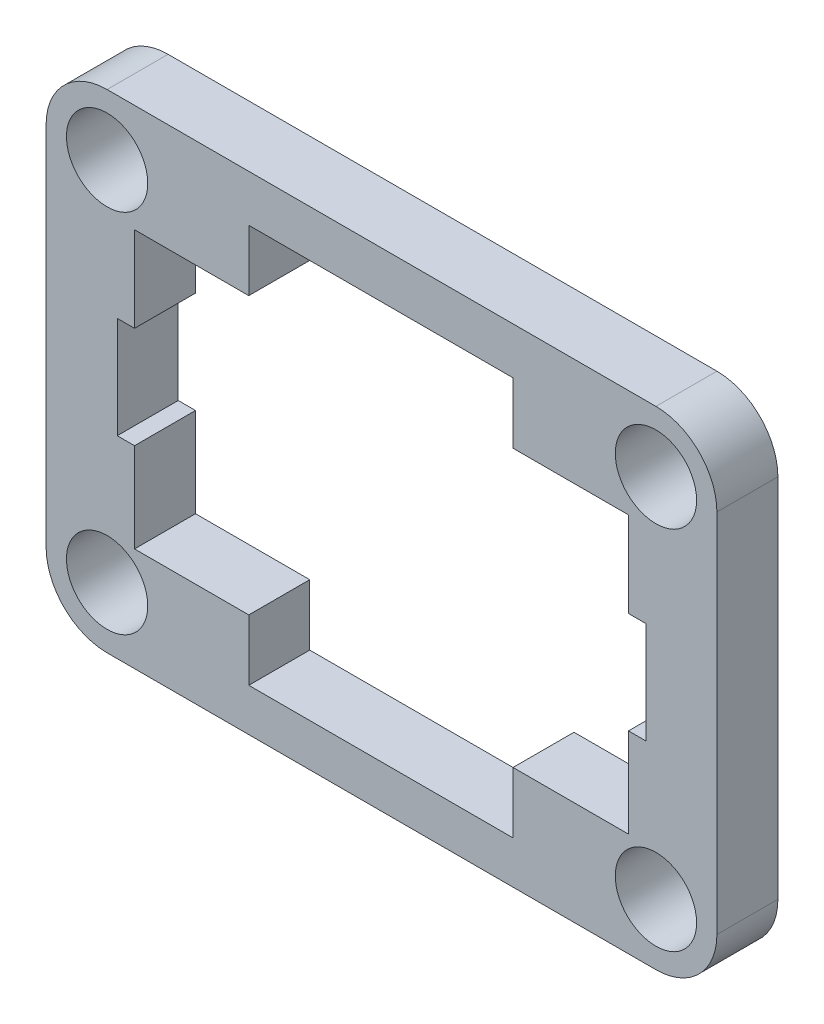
SolidWorks part; units mm, degrees
ref_plane "Front Plane" through (0, 0, 0) normal (0, 0, 1) x (1, 0, 0)
ref_plane "Top Plane" through (0, 0, 0) normal (0, 1, 0) x (1, 0, 0)
ref_plane "Right Plane" through (0, 0, 0) normal (1, 0, 0) x (0, 0, -1)
imported_body "Imported1"
sketch "Sketch1" plane through (0, 0, 0) normal (0, 0, 1) x (1, 0, 0)
  line L0 (28.38, -15.95) -> (34, -15.95)
  line L1 (47, -15.95) -> (52.68, -15.95)
  line L2 (28.38, -15.95) -> (28.38, -29.55)
  line L4 (52.68, -15.95) -> (52.68, -29.55)
  line L5 (52.68, -29.55) -> (47, -29.55)
  line L6 (34, -15.95) -> (34, -12.95)
  line L7 (34, -12.95) -> (47, -12.95)
  line L8 (47, -15.95) -> (47, -12.95)
  line L9 (34, -29.55) -> (28.38, -29.55)
  line L10 (47, -29.55) -> (47, -32.55)
  line L11 (47, -32.55) -> (34, -32.55)
  line L12 (34, -29.55) -> (34, -32.55)
extrude "Cut-Extrude1" cut sketch "Sketch1" along normal blind 3
sketch "Sketch2" plane through (0, 0, 3) normal (0, 0, 1) x (1, 0, 0)
  circle A0 centre (27.0303, -13.6514) radius 2
  circle A1 centre (54.0303, -13.6514) radius 2
  circle A2 centre (54.0303, -31.6514) radius 2
  circle A3 centre (27.0303, -31.6514) radius 2
extrude "Cut-Extrude2" cut sketch "Sketch2" against normal blind 3
